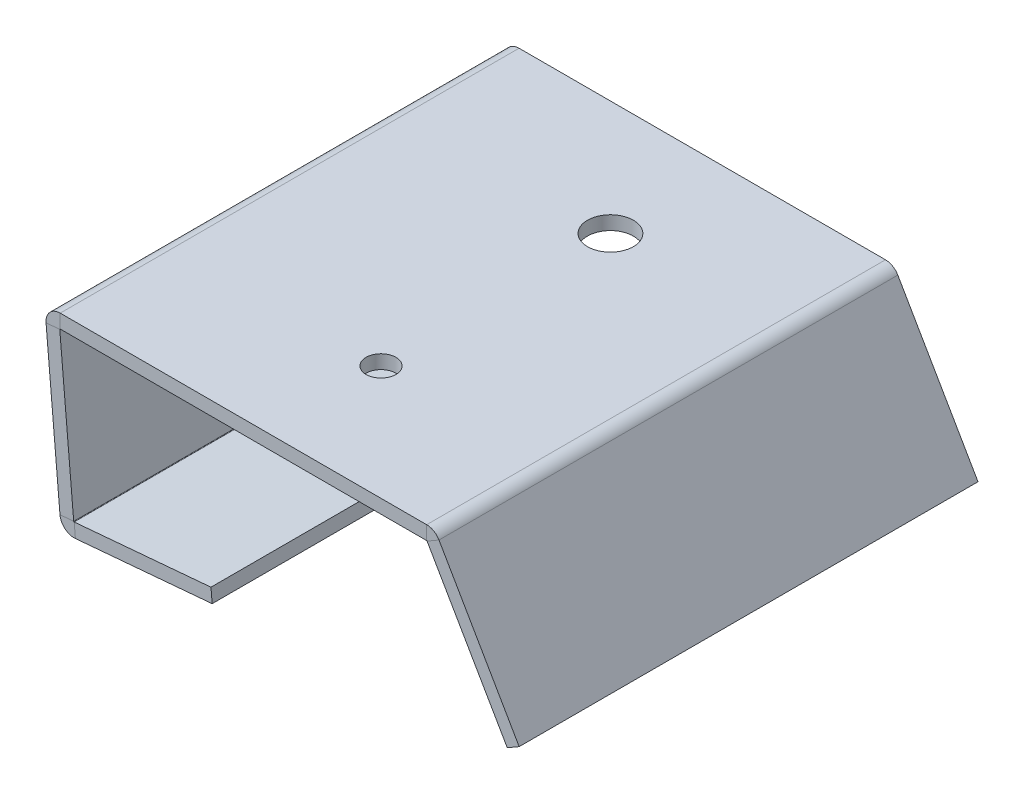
SolidWorks part; units mm, degrees
ref_plane "Front Plane" through (0, 0, 0) normal (0, 0, 1) x (1, 0, 0)
ref_plane "Top Plane" through (0, 0, 0) normal (0, 1, 0) x (1, 0, 0)
ref_plane "Right Plane" through (0, 0, 0) normal (1, 0, 0) x (0, 0, -1)
sketch "Sketch1" plane through (0, 0, 0) normal (0, 1, 0) x (1, 0, 0)
  line L0 (0, 50) -> (180, 50) construction
  line L1 (0, 0) -> (180, 0)
  line L2 (0, 0) -> (0, 100)
  line L3 (0, 100) -> (180, 100)
  line L4 (180, 0) -> (180, 100)
  circle A0 centre (55, 50) radius 2.25
  circle A1 centre (110, 75) radius 5
  circle A2 centre (110, 25) radius 3.25
  dimension "D3" = 4.5
  dimension "D4" = 55
  dimension "D5" = 10
  dimension "D6" = 6.5
  dimension "D9" = 25
  dimension "D10" = 25
  dimension "D1" = 100
  dimension "D2" = 180
  dimension "D7" = 70
  dimension "D8" = 70
sheet metal parameters "Sheet-Metal1" thickness 3 parameters "D1"=0.1
base flange "Base-Flange1" sketch "Sketch1" thickness 3 reverse thickness direction yes parameters "D1"=0.1
sketch "Sketch3" plane through (0, 3, 0) normal (0, 1, 0) x (1, 0, 0)
  line L0 (30, 100) -> (30, 0)
  line L1 (180, 100) -> (0, 100) construction
  line L2 (0, 0) -> (180, 0) construction
  line L3 (0, 100) -> (0, 0) construction
  dimension "D1" = 30
sketched bend "Sketched Bend1" parameters "D1"=0.1
bend "SketchBend1" bend radius 0.1 bend angle 90 parameters "D5"=1
sketch "Sketch4" plane through (0, 3, 0) normal (0, 1, 0) x (1, 0, 0)
  line L0 (65, 100) -> (65, 0)
  line L1 (180, 100) -> (30.0786, 100) construction
  line L2 (30.0786, 0) -> (180, 0) construction
  line L3 (180, 0) -> (180, 100) construction
  dimension "D1" = 115
sketched bend "Sketched Bend2" parameters "D1"=0.1
bend "SketchBend2" bend radius 0.1 bend angle 95 parameters "D5"=2
sketch "Sketch5" plane through (0, 3, 0) normal (0, 1, 0) x (1, 0, 0)
  line L0 (145, 100) -> (145, 0)
  line L1 (180, 100) -> (65.0829, 100) construction
  line L2 (65.0829, 0) -> (180, 0) construction
  line L3 (180, 0) -> (180, 100) construction
  dimension "D1" = 35
sketched bend "Sketched Bend3" parameters "D1"=0.1
bend "SketchBend3" bend radius 0.1 bend angle 60 parameters "D5"=3
flat pattern "Flat-Pattern1"
sketch "Bend-Lines1" plane through (0, 0, 0) normal (0, 1, 0) x (-1, 0, 0)
bend of the flat pattern "Flatten-<SketchBend1>1"
bend of the flat pattern "Flatten-<SketchBend2>1"
bend of the flat pattern "Flatten-<SketchBend3>1"
